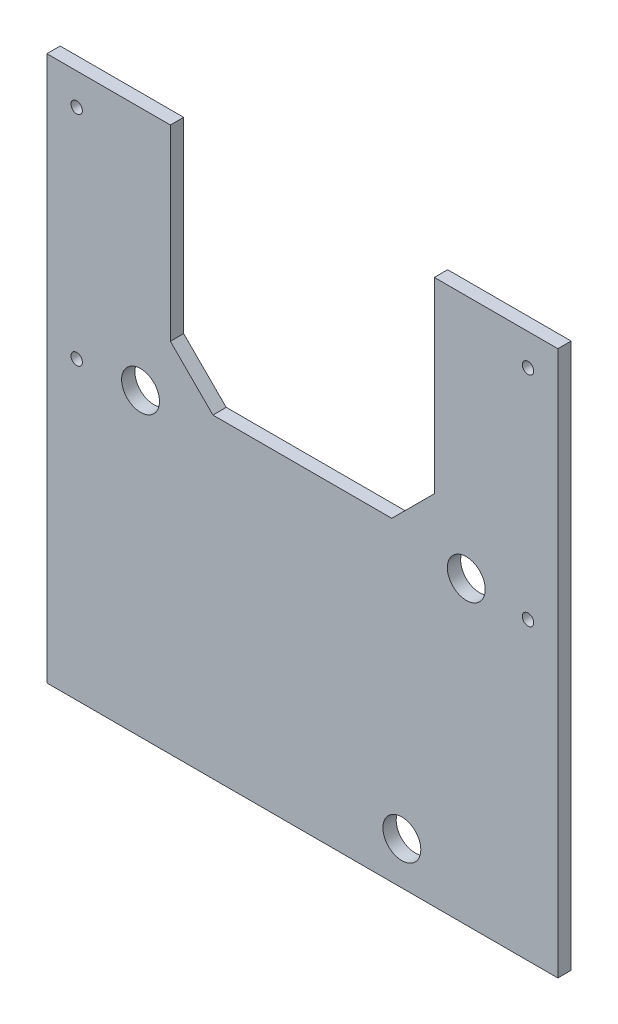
SolidWorks part; units mm, degrees
ref_plane "Front" through (0, 0, 0) normal (0, 0, 1) x (1, 0, 0)
ref_plane "Top" through (0, 0, 0) normal (0, 1, 0) x (1, 0, 0)
ref_plane "Right" through (0, 0, 0) normal (1, 0, 0) x (0, 0, -1)
sketch "Sketch1" plane through (0, 0, 0) normal (0, 0, 1) x (1, 0, 0)
  line L0 (15.24, -15.24) -> (15.24, -20.32)
  line L1 (-15.24, 15.24) -> (15.24, 15.24)
  line L2 (-15.24, 15.24) -> (-15.24, -15.24)
  line L3 (-15.24, -15.24) -> (15.24, -15.24) construction
  line L4 (15.24, 15.24) -> (15.24, -15.24)
  line L5 (15.24, -20.32) -> (-15.24, -20.32)
  line L6 (-15.24, -20.32) -> (-15.24, -15.24)
  point P4 (0, -15.24)
  point P5 (15.24, 0)
  dimension "D1" = 30.48
  dimension "D2" = 5.08
extrude "Extrude1" add sketch "Sketch1" along normal blind 0.7937
sketch "Sketch2" plane through (0, 0, 0.7937) normal (0, 0, 1) x (1, 0, 0)
  line L0 (15.24, -20.32) -> (15.24, 15.24) construction
  line L1 (-15.24, 15.24) -> (15.24, 15.24)
  line L2 (-15.24, 15.24) -> (-15.24, 5.842)
  line L3 (-15.24, 5.842) -> (15.24, 5.842)
  line L4 (15.24, 15.24) -> (15.24, 5.842)
  line L5 (-15.24, -20.32) -> (15.24, -20.32) construction
  dimension "D1" = 26.162
extrude "Cut-Extrude1" cut sketch "Sketch2" against normal through all
sketch "Sketch3" plane through (0, 0, 0.7937) normal (0, 0, 1) x (1, 0, 0)
  line L0 (-15.24, 5.842) -> (15.24, 5.842) construction
  line L1 (-7.874, 5.842) -> (7.874, 5.842)
  line L2 (-7.874, 5.842) -> (-7.874, -7.874)
  line L3 (-7.874, -7.874) -> (7.874, -7.874)
  line L4 (7.874, 5.842) -> (7.874, -7.874)
  line L5 (-15.24, -20.32) -> (15.24, -20.32) construction
  point P4 (0, -7.874)
  dimension "D1" = 12.446
  dimension "D2" = 15.748
extrude "Cut-Extrude2" cut sketch "Sketch3" against normal through all
chamfer "Chamfer1" [suppressed] distance 7.62 angle 45
sketch "Sketch4" plane through (0, -20.32, 0) normal (0, -1, 0) x (1, 0, 0)
  line L1 (15.24, 0.7937) -> (-15.24, 0.7937)
  line L2 (15.24, 0.7937) -> (15.24, 0)
  line L3 (15.24, 0) -> (-15.24, 0)
  line L4 (-15.24, 0.7937) -> (-15.24, 0)
extrude "Extrude2" add sketch "Sketch4" along normal blind 6.35
hole_wizard "#43 (0.089) Diameter Hole1" positions "Sketch6" profile "Sketch5" hole size "#43" standard "Ansi Inch"
sketch "Sketch6" plane through (0, 0, 0.7937) normal (0, 0, 1) x (1, 0, 0)
  circle A3 centre (-9.652, -8.763) radius 0.889 construction
  circle A4 centre (9.779, -8.763) radius 0.889 construction
  circle A5 centre (5.936, -24.13) radius 0.889 construction
  point P0 (9.779, -8.763)
  point P1 (5.936, -24.13)
  point P2 (-9.652, -8.763)
sketch "Sketch5" plane through (9.779, -8.763, 0.7937) normal (1, 0, 0) x (0, -1, 0)
  line L0 (0, 0) -> (0, 0.7937)
  line L1 (0, 0.7937) -> (1.1303, 0.7937)
  line L2 (1.1303, 0.7937) -> (1.1303, 0)
  line L5 (1.1303, 0) -> (0, 0)
  line L11 (0, -6.35) -> (0, 107.95) construction
  dimension "Thru Hole Dia." = 2.2606
  dimension "Thru Hole Depth" = 0.7937
sketch "Sketch7" plane through (0, 0, 0.7937) normal (0, 0, 1) x (1, 0, 0)
  circle A0 centre (13.462, -9.04) radius 0.3394
  circle A1 centre (13.462, -9.04) radius 0.25 construction
  circle A2 centre (13.462, 3.96) radius 0.3394
  circle A3 centre (-13.462, 3.96) radius 0.3394
  circle A4 centre (-13.462, -9.04) radius 0.3394
  circle A5 centre (13.462, 3.96) radius 0.25 construction
  circle A6 centre (-13.462, 3.96) radius 0.25 construction
  circle A7 centre (-13.462, -9.04) radius 0.25 construction
  dimension "D1" = 0.6788
extrude "Cut-Extrude3" cut sketch "Sketch7" against normal through all
chamfer "Chamfer2" distance 2.54 angle 45 2 edges at (7.874, -7.874, 0.3969) (-7.874, -7.874, 0.3969)
